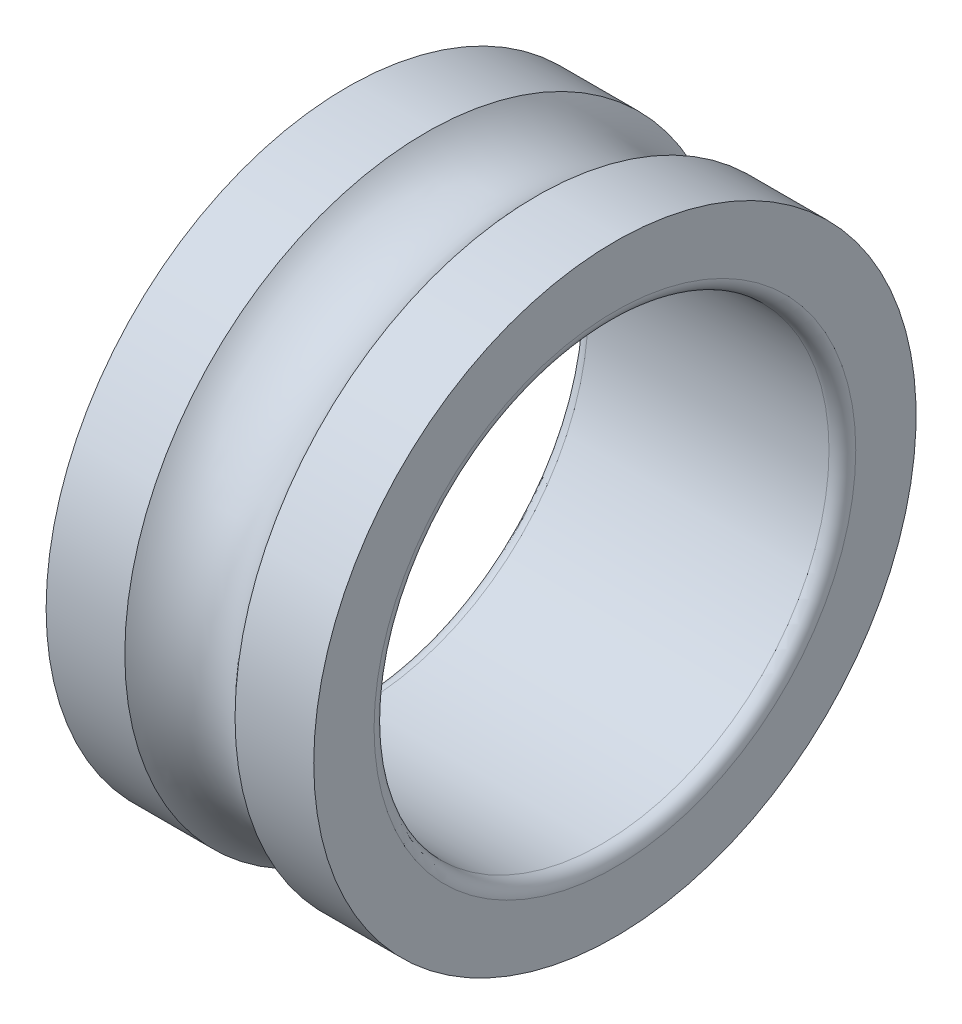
SolidWorks part; units mm, degrees
ref_plane "Face" through (0, 0, 0) normal (0, 0, 1) x (1, 0, 0)
ref_plane "Dessus" through (0, 0, 0) normal (0, 1, 0) x (1, 0, 0)
ref_plane "Droite" through (0, 0, 0) normal (1, 0, 0) x (0, 0, -1)
sketch "Esquisse1" plane through (0, 0, 0) normal (0, 0, 1) x (1, 0, 0)
  line L0 (0, 11.254) -> (0, 9)
  line L1 (0.5, 8.5) -> (9.5, 8.5)
  line L2 (10, 9) -> (10, 11.254)
  line L3 (10, 11.254) -> (7.0595, 11.254)
  line L4 (2.9405, 11.254) -> (0, 11.254)
  line L5 (10, 0) -> (0, 0) construction
  arc A0 (0, 9) -> (0.5, 8.5) centre (0.5, 9) ccw
  arc A1 (9.5, 8.5) -> (10, 9) centre (9.5, 9) ccw
  arc A2 (7.0595, 11.254) -> (2.9405, 11.254) centre (5, 13) cw
revolve "Révolution1" add sketch "Esquisse1" angle 360 about L5
